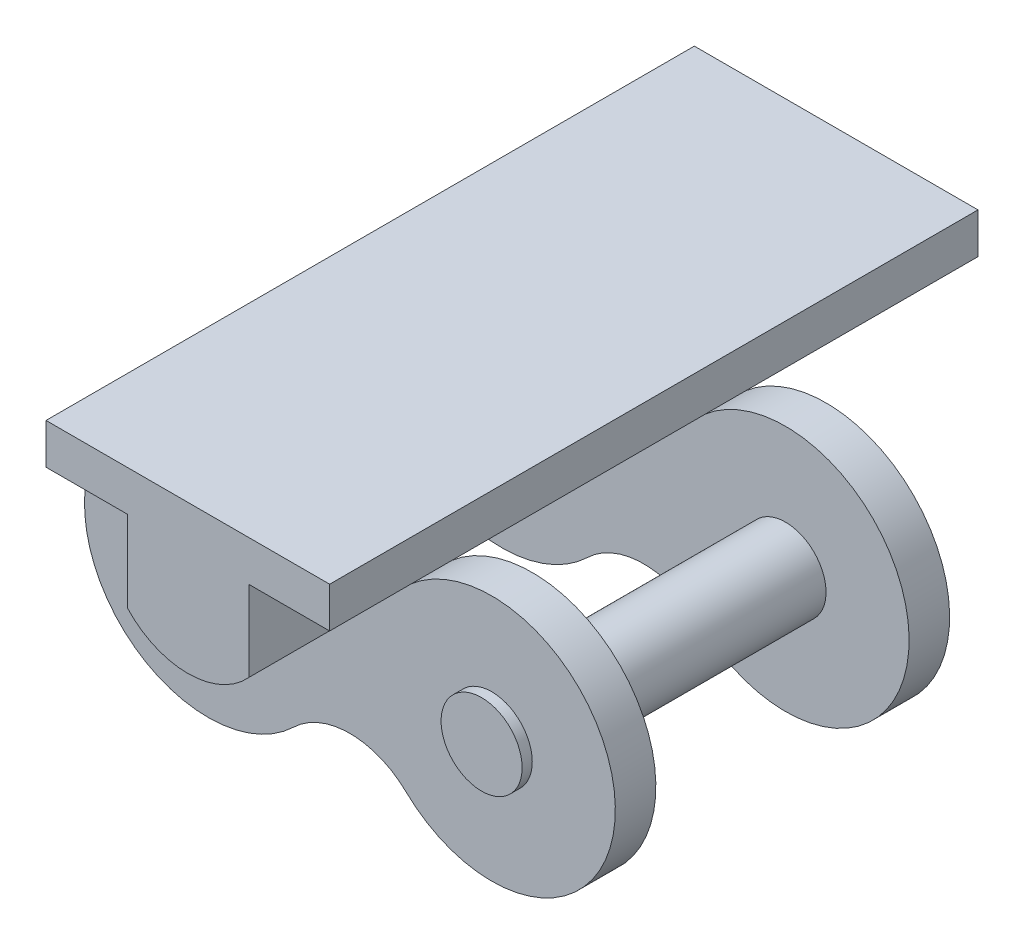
SolidWorks part; units mm, degrees
ref_plane "Alzado" through (0, 0, 0) normal (0, 0, 1) x (1, 0, 0)
ref_plane "Planta" through (0, 0, 0) normal (0, 1, 0) x (1, 0, 0)
ref_plane "Vista lateral" through (0, 0, 0) normal (1, 0, 0) x (0, 0, -1)
sketch "Croquis1" plane through (0, 0, 0) normal (0, 0, 1) x (1, 0, 0)
  line L0 (0, 8.0804) -> (0, 3.2808) construction
  line L1 (-12.4809, 0) -> (13.405, 0) construction
  line L2 (0, -3.2808) -> (0, -10.9407) construction
  arc A0 (-2.7723, 4.3973) -> (-2.7723, -4.3973) centre (-7, 0) ccw
  circle A1 centre (-7, 0) radius 2
  arc A2 (2.7723, 4.3973) -> (2.7723, -4.3973) centre (7, 0) cw
  circle A3 centre (7, 0) radius 2
  arc A4 (-2.7723, 4.3973) -> (2.7723, 4.3973) centre (0, 7.2808) ccw
  arc A5 (-2.7723, -4.3973) -> (2.7723, -4.3973) centre (0, -7.2808) cw
  dimension "D1" = 12.2
  dimension "D2" = 4
  dimension "D4" = 4
  dimension "D3" = 7
extrude "Saliente-Extruir1" add sketch "Croquis1" along normal blind 2
sketch "Croquis2" plane through (0, 0, 2) normal (0, 0, 1) x (1, 0, 0)
  circle A0 centre (7, 0) radius 2 construction
  circle A1 centre (-7, 0) radius 2 construction
  circle A2 centre (7, 0) radius 2
  circle A3 centre (-7, 0) radius 2
extrude "Saliente-Extruir2" add sketch "Croquis2" along normal blind 15 and the other way blind 2.5
ref_plane "Plano1" through (0, 0, 8.25) normal (0, 0, 1) x (1, 0, 0)
mirror "Simetría1" about plane through (0, 0, 8.25) normal (0, 0, 1) of "Saliente-Extruir1"
sketch "Croquis3" plane through (0, 0, 16.5) normal (0, 0, 1) x (1, 0, 0)
  line L0 (-2.9896, 4.5964) -> (-2.9896, 8.5964)
  line L1 (3.0104, 4.6145) -> (3.0104, 8.5964)
  line L2 (-7, 8.5964) -> (-2.9896, 8.5964)
  line L3 (-7, 8.5964) -> (-7, 10.5964)
  line L4 (-7, 10.5964) -> (7, 10.5964)
  line L5 (7, 8.5964) -> (7, 10.5964)
  line L6 (3.0104, 8.5964) -> (7, 8.5964)
  line L7 (0, 0) -> (0, 13.8711) construction
  arc A1 (-2.7723, 4.3973) -> (-2.7723, -4.3973) centre (-7, 0) ccw construction
  arc A2 (2.7723, -4.3973) -> (2.7723, 4.3973) centre (7, 0) ccw construction
  arc A4 (-2.9896, 4.5964) -> (3.0104, 4.6145) centre (0.0022, 7.3403) ccw
  point P8 (0, 10.5964)
  dimension "D3" = 4.0595
  dimension "D4" = 14
  dimension "D1" = 4
  dimension "D2" = 6
  dimension "D5" = 2
  dimension "D6" = 0.2382
extrude "Saliente-Extruir3" add sketch "Croquis3" against normal blind 24 and the other way blind 8
